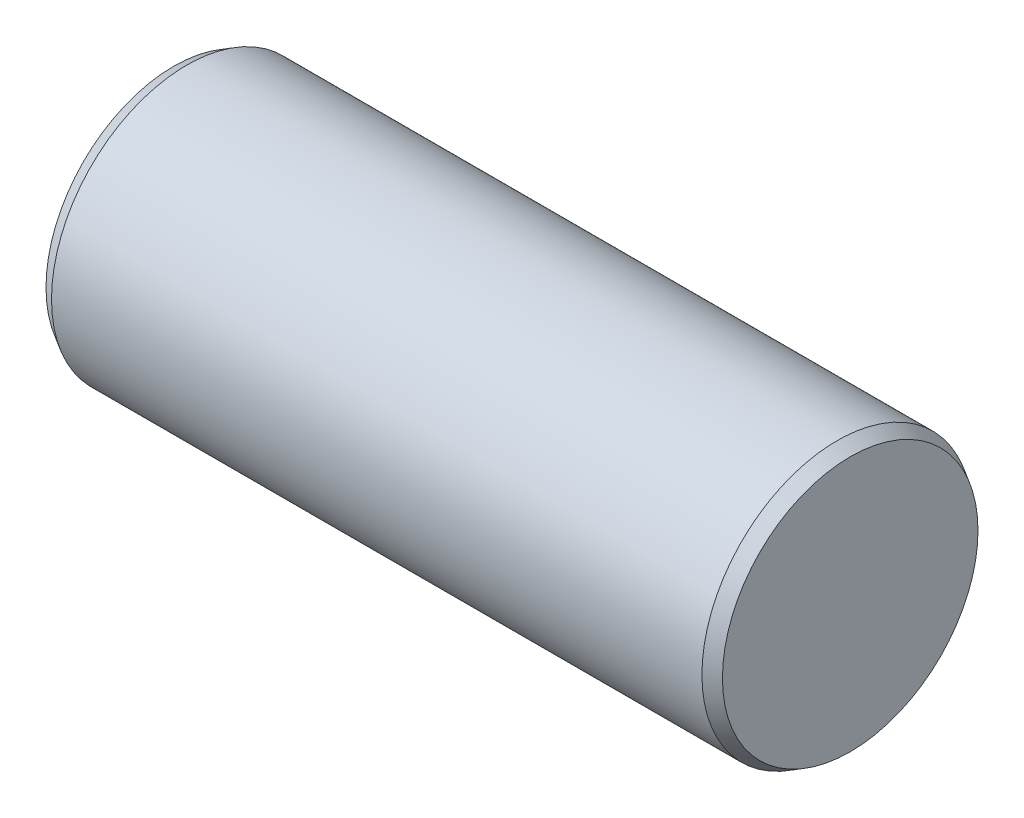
SolidWorks part; units mm, degrees
ref_plane "Plan de face" through (0, 0, 0) normal (0, 0, 1) x (1, 0, 0)
ref_plane "Plan de dessus" through (0, 0, 0) normal (0, 1, 0) x (1, 0, 0)
ref_plane "Plan de droite" through (0, 0, 0) normal (1, 0, 0) x (0, 0, -1)
sketch "Esquisse1" plane through (0, 0, 0) normal (1, 0, 0) x (0, 0, -1)
  circle A0 centre (0, 0) radius 9
  dimension "D1" = 18
extrude "Boss.-Extru.1" add sketch "Esquisse1" along normal mid plane 45
chamfer "Chanfrein1" distance 0.5 angle 60 2 edges at (-22.5, 0, -9) (22.5, 0, -9)
